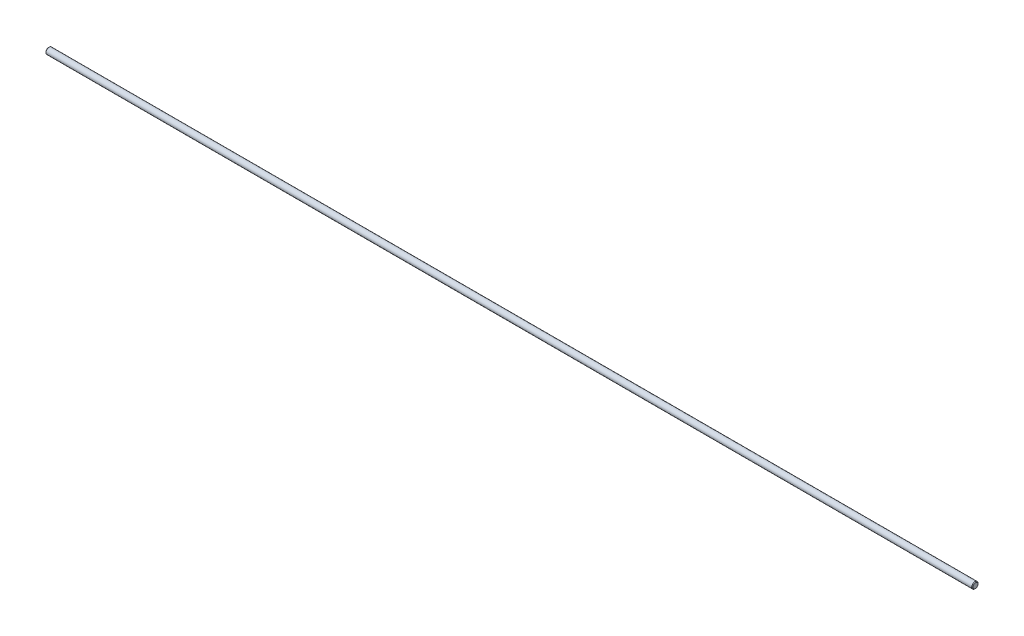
SolidWorks part; units mm, degrees
ref_plane "Plan de face" through (0, 0, 0) normal (0, 0, 1) x (1, 0, 0)
ref_plane "Plan de dessus" through (0, 0, 0) normal (0, 1, 0) x (1, 0, 0)
ref_plane "Plan de droite" through (0, 0, 0) normal (1, 0, 0) x (0, 0, -1)
sketch "Esquisse1" plane through (0, 0, 0) normal (1, 0, 0) x (0, 0, -1)
  circle A0 centre (0, 0) radius 5
  dimension "D1" = 10
extrude "Extrusion1" add sketch "Esquisse1" along normal mid plane 1478
chamfer "Chanfrein1" distance 1 angle 45 2 edges at (739, 0, -5) (-739, 0, -5)
